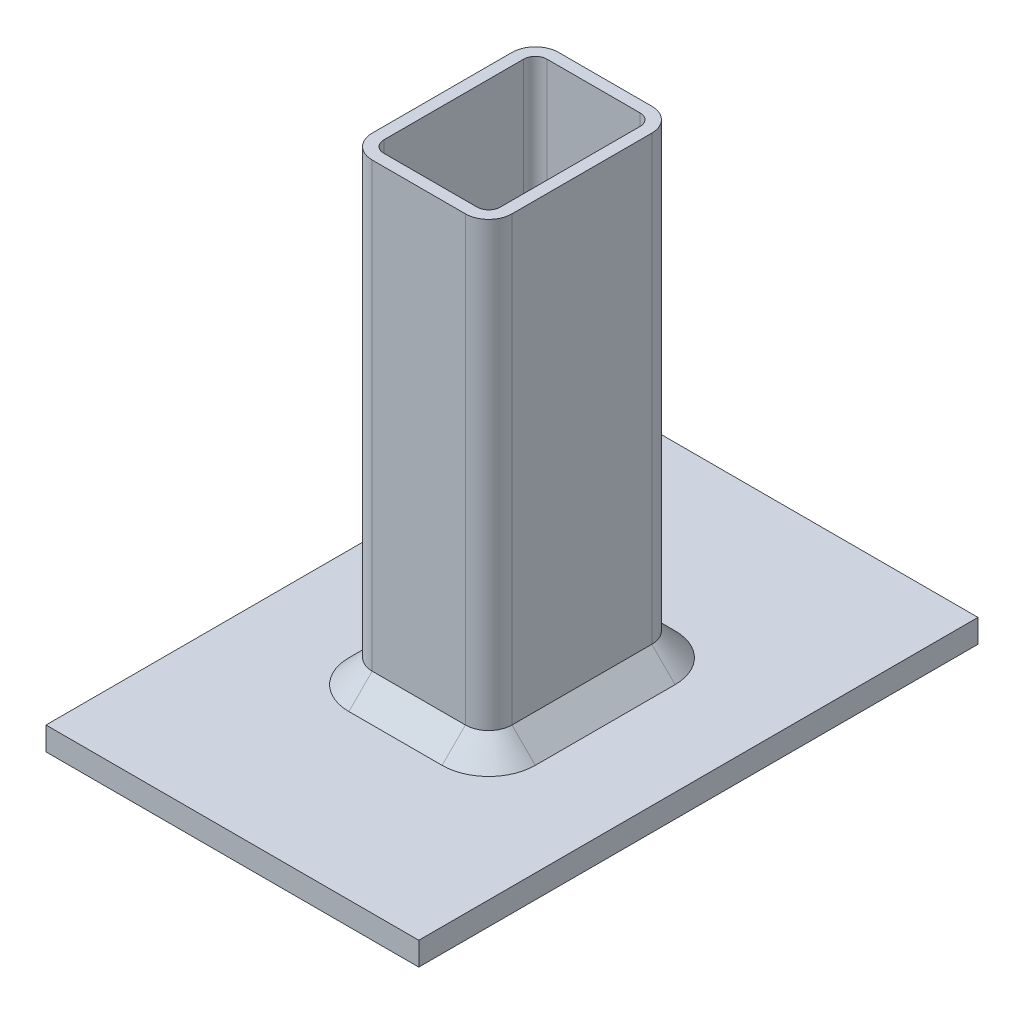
SolidWorks part; units mm, degrees
other "DetailItem2"
ref_plane "Front Plane" through (0, 0, 0) normal (0, 0, 1) x (1, 0, 0)
ref_plane "Top Plane" through (0, 0, 0) normal (0, 1, 0) x (1, 0, 0)
ref_plane "Right Plane" through (0, 0, 0) normal (1, 0, 0) x (0, 0, -1)
sketch "Sketch1" plane through (0, 0, 0) normal (0, 0, 1) x (1, 0, 0)
  line L0 (0, 0) -> (0, 254)
  dimension "D1" = 254
other "Structural Member1"
ref_plane "Plane1" through (0, 0, 0) normal (0, 1, 0) x (-1, 0, 0)
sketch "Sketch11" plane through (0, 0, 0) normal (0, 1, 0) x (-1, 0, 0)
  line L0 (-25.4, -44.45) -> (25.4, -44.45)
  line L1 (-31.75, -38.1) -> (-31.75, 38.1)
  line L2 (25.4, 44.45) -> (-25.4, 44.45)
  line L3 (31.75, 38.1) -> (31.75, -38.1)
  line L4 (-25.4, -50.8) -> (25.4, -50.8)
  line L5 (-38.1, -38.1) -> (-38.1, 38.1)
  line L6 (25.4, 50.8) -> (-25.4, 50.8)
  line L7 (38.1, 38.1) -> (38.1, -38.1)
  line L8 (0, 0) -> (38.1, 0) construction
  line L9 (0, 0) -> (0, 50.8) construction
  arc A0 (38.1, 38.1) -> (25.4, 50.8) centre (25.4, 38.1) ccw
  arc A1 (25.4, -50.8) -> (38.1, -38.1) centre (25.4, -38.1) ccw
  arc A2 (-38.1, -38.1) -> (-25.4, -50.8) centre (-25.4, -38.1) ccw
  arc A3 (-25.4, 50.8) -> (-38.1, 38.1) centre (-25.4, 38.1) ccw
  arc A4 (-25.4, 44.45) -> (-31.75, 38.1) centre (-25.4, 38.1) ccw
  arc A5 (31.75, 38.1) -> (25.4, 44.45) centre (25.4, 38.1) ccw
  arc A6 (25.4, -44.45) -> (31.75, -38.1) centre (25.4, -38.1) ccw
  arc A7 (-31.75, -38.1) -> (-25.4, -44.45) centre (-25.4, -38.1) ccw
  point P3 (0, -50.8)
  point P4 (-38.1, 0)
  point P5 (0, 0)
  point P6 (38.1, -50.8)
  point P7 (-38.1, -50.8)
  point P8 (-38.1, 50.8)
  point P33 (0, 0)
  point P35 (38.1, 50.8)
  point P36 (38.1, 0)
  point P37 (0, 50.8)
  dimension "D1" = 12.7
  dimension "Thickness" = 6.35
  dimension "V_leg" = 101.6
  dimension "H_leg" = 76.2
sketch "Sketch21" plane through (0, 0, 0) normal (0, -1, 0) x (1, 0, 0)
  line L0 (-101.6, 152.4) -> (101.6, -152.4) construction
  line L1 (101.6, -152.4) -> (-101.6, -152.4)
  line L2 (101.6, -152.4) -> (101.6, 152.4)
  line L3 (101.6, 152.4) -> (-101.6, 152.4)
  line L4 (-101.6, -152.4) -> (-101.6, 152.4)
  dimension "D1" = 203.2
  dimension "D2" = 304.8
extrude "Boss-Extrude3" add sketch "Sketch21" along normal blind 12.7 separate body
other "Fillet Bead2" parameters "D10"=6.35, "D11"=12.7, "D12"=0, "D13"=3.175, "D14"=0
